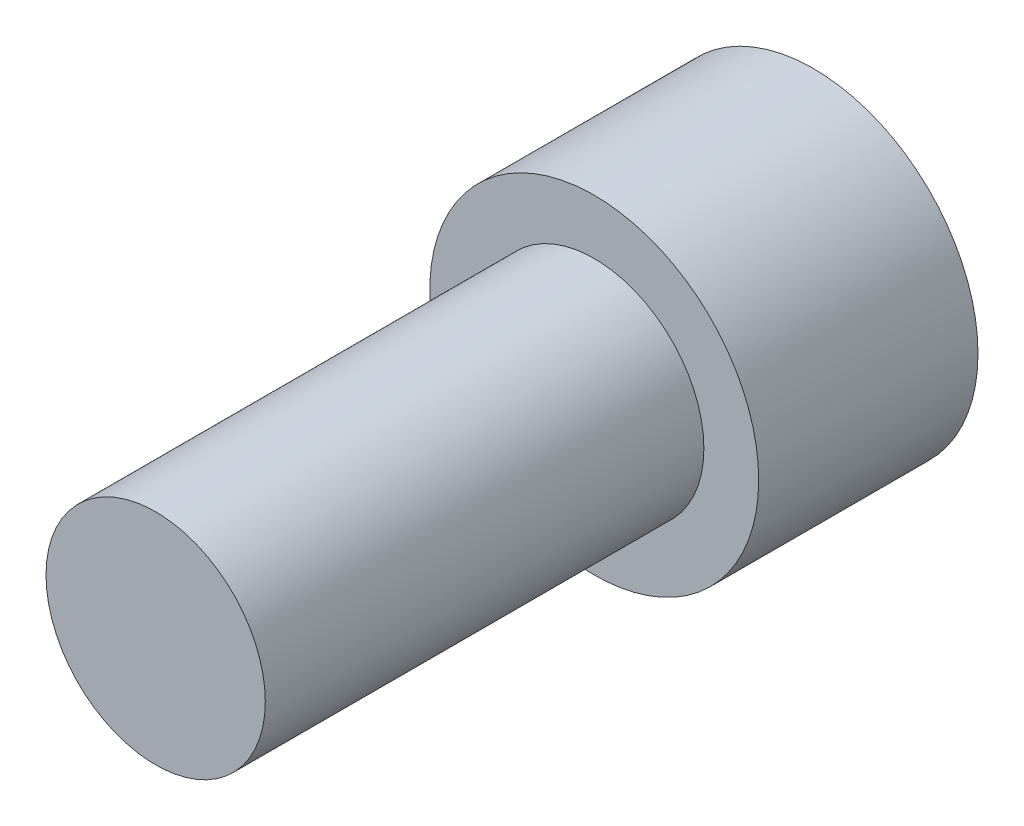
SolidWorks part; units mm, degrees
ref_plane "Front Plane" through (0, 0, 0) normal (0, 0, 1) x (1, 0, 0)
ref_plane "Top Plane" through (0, 0, 0) normal (0, 1, 0) x (1, 0, 0)
ref_plane "Right Plane" through (0, 0, 0) normal (1, 0, 0) x (0, 0, -1)
sketch "Sketch6" plane through (0, 0, 0) normal (1, 0, 0) x (0, 0, -1)
  line L0 (-25.4, 0) -> (22.525, 0) construction
  line L1 (10.4775, 0) -> (-10.4775, 0) construction
  line L2 (-25.4, 0) -> (-25.4, -6.35)
  line L3 (-25.4, -6.35) -> (0, -6.35)
  line L4 (0, 10.4775) -> (0, -10.4775) construction
  line L5 (0, -6.35) -> (0, -9.525)
  line L6 (0, -9.525) -> (12.7, -9.525)
  line L7 (12.7, -9.525) -> (12.7, 0)
  line L8 (12.7, 0) -> (-25.4, 0)
  dimension "L" = 25.4
  dimension "H" = 12.7
  dimension "A" = 19.05
  dimension "D" = 12.7
revolve "Revolve1" add sketch "Sketch6" angle 360 about L0
sketch "Sketch7" plane through (0, 0, -12.7) normal (0, 0, -1) x (-1, 0, 0)
  line L2 (-4.7625, 2.7496) -> (-4.7625, -2.7496)
  line L4 (-4.7625, -2.7496) -> (0, -5.4993)
  line L5 (0, -5.4993) -> (4.7625, -2.7496)
  line L6 (4.7625, -2.7496) -> (4.7625, 2.7496)
  line L7 (4.7625, 2.7496) -> (0, 5.4993)
  line L8 (0, 5.4993) -> (-4.7625, 2.7496)
  circle A0 centre (0, 0) radius 4.7625 construction
  dimension "J" = 9.525
extrude "HEX" cut sketch "Sketch7" against normal blind 7.112
